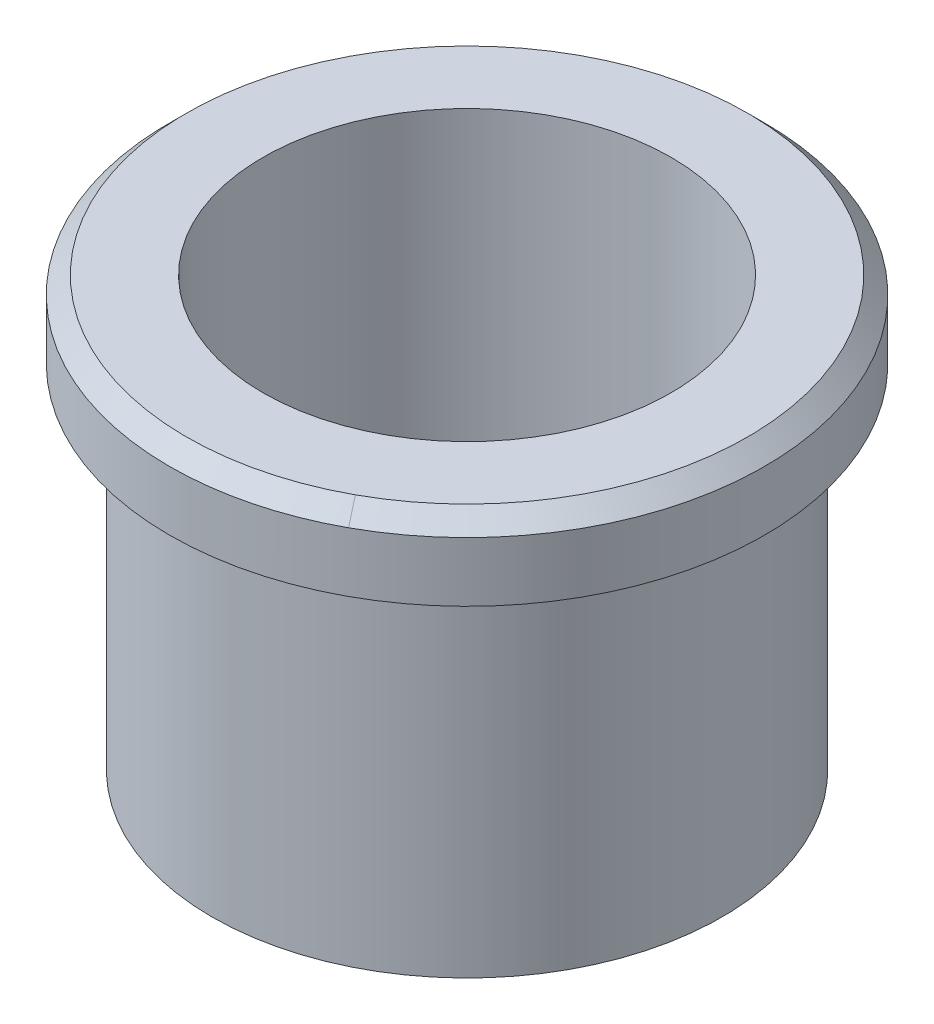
SolidWorks part; units mm, degrees
ref_plane "Plan de face" through (0, 0, 0) normal (0, 0, 1) x (1, 0, 0)
ref_plane "Plan de dessus" through (0, 0, 0) normal (0, 1, 0) x (1, 0, 0)
ref_plane "Plan de droite" through (0, 0, 0) normal (1, 0, 0) x (0, 0, -1)
imported_body "Importée1"
sketch "Esquisse1" plane through (0, -25.5, 0) normal (0, -1, 0) x (1, 0, 0)
  circle A0 centre (0, 0) radius 12 construction
  circle A1 centre (0, 0) radius 15
  circle A2 centre (0, 0) radius 15
  circle A3 centre (0, 0) radius 12
  dimension "D1" = 0
extrude "Enlèv. mat.-Extru.1" cut sketch "Esquisse1" against normal blind 0.3
